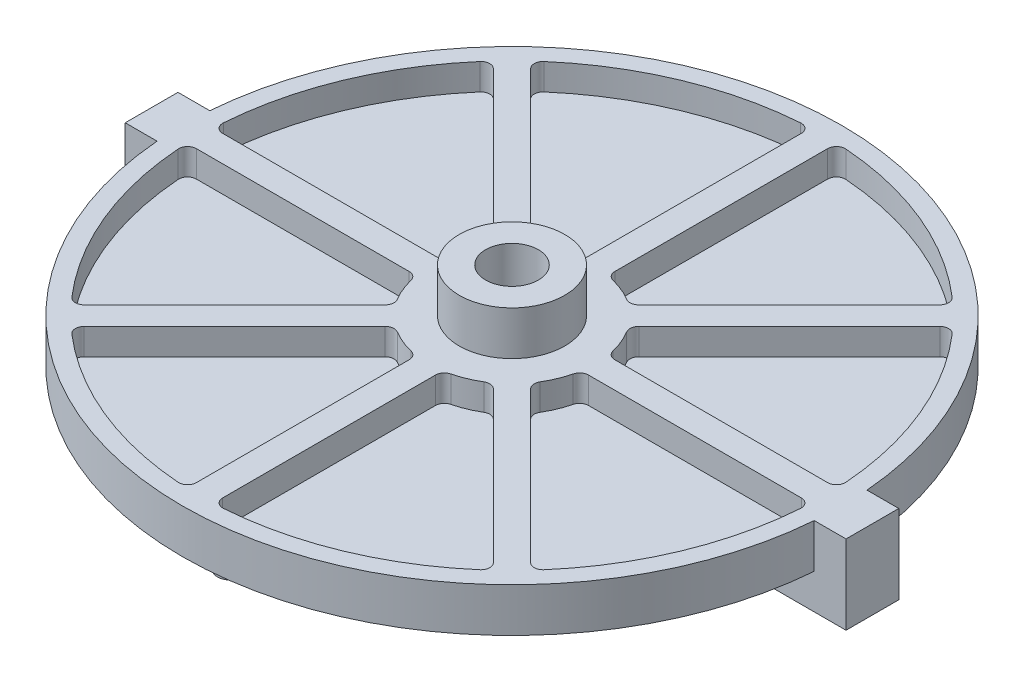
SolidWorks part; units mm, degrees
ref_plane "Front Plane" through (0, 0, 0) normal (0, 0, 1) x (1, 0, 0)
ref_plane "Top Plane" through (0, 0, 0) normal (0, 1, 0) x (1, 0, 0)
ref_plane "Right Plane" through (0, 0, 0) normal (1, 0, 0) x (0, 0, -1)
sketch "Sketch1" plane through (0, 0, 0) normal (0, 1, 0) x (1, 0, 0)
  circle A0 centre (0, 0) radius 37.5
  dimension "D1" = 75
extrude "Boss-Extrude1" add sketch "Sketch1" along normal blind 5
shell "Shell1" thickness 2
sketch "Sketch2" plane through (0, 2, 0) normal (0, 1, 0) x (1, 0, 0)
  circle A0 centre (0, 0) radius 9.5
  dimension "D1" = 19
extrude "Boss-Extrude2" add sketch "Sketch2" along normal up to surface (3 mm away)
sketch "Sketch3" plane through (0, 5, 0) normal (0, 1, 0) x (1, 0, 0)
  circle A0 centre (0, 0) radius 6
  dimension "D1" = 12
extrude "Boss-Extrude3" add sketch "Sketch3" along normal blind 5
sketch "Sketch4" plane through (0, 5, 0) normal (0, 1, 0) x (1, 0, 0)
  line L0 (0, 0) -> (35.5, 0)
  circle A0 centre (0, 0) radius 35.5 construction
rib "Rib1" sketch "Sketch4" sketch "Sketch4" thickness 3 extrusion direction normal to sketch draft on no parameters "D1"=3
pattern_circular "CirPattern1" count 8 over 360 about axis through (0, 0, 0) along (0, 1, 0) of "Rib1"
sketch "Sketch5" plane through (0, 0, 0) normal (0, -1, 0) x (1, 0, 0)
  line L0 (0, -17) -> (0, -32) construction
  line L1 (1.5, -17) -> (1.5, -32)
  line L2 (-1.5, -17) -> (-1.5, -32)
  line L3 (1.5, -35.4683) -> (1.5, -9.3808) construction
  arc A0 (1.5, -17) -> (-1.5, -17) centre (0, -17) ccw
  arc A1 (-1.5, -32) -> (1.5, -32) centre (0, -32) ccw
  circle A2 centre (0, 0) radius 32 construction
  point P3 (0, -24.5)
  dimension "D2" = 64
  dimension "D1" = 15
extrude "Boss-Extrude4" add sketch "Sketch5" along normal blind 4
mirror "Mirror1" about plane through (0, 0, 0) normal (0, 0, 1) of "Boss-Extrude4"
sketch "Sketch6" plane through (0, 0, 0) normal (0, -1, 0) x (1, 0, 0)
  line L0 (0, 0) -> (37.5, 0) construction
  line L1 (0, 0) -> (0, 40.6224) construction
  line L2 (-41, 3) -> (41, 3)
  line L3 (-41, 3) -> (-41, -3)
  line L4 (-41, -3) -> (41, -3)
  line L5 (41, 3) -> (41, -3)
  circle A0 centre (0, 0) radius 37.5 construction
  dimension "D1" = 82
  dimension "D2" = 6
extrude "Boss-Extrude5" add sketch "Sketch6" along normal up to surface (4 mm away)
sketch "Sketch7" plane through (0, 0, 0) normal (0, 1, 0) x (1, 0, 0)
  line L3 (41, 3) -> (37.3798, 3)
  line L4 (37.3798, -3) -> (41, -3)
  line L5 (41, -3) -> (41, 3)
  line L6 (41, 3) -> (37.3798, 3)
  line L7 (37.3798, -3) -> (41, -3)
  line L8 (41, -3) -> (41, 3)
  arc A1 (37.3798, -3) -> (37.3798, 3) centre (0, 0) ccw
  arc A2 (37.3798, -3) -> (37.3798, 3) centre (0, 0) ccw
  dimension "D1" = 0
extrude "Boss-Extrude6" add sketch "Sketch7" along normal up to surface (5 mm away)
sketch "Sketch8" plane through (0, 0, 0) normal (0, 1, 0) x (1, 0, 0)
  line L3 (-41, -3) -> (-37.3798, -3)
  line L4 (-37.3798, 3) -> (-41, 3)
  line L5 (-41, 3) -> (-41, -3)
  line L6 (-41, -3) -> (-37.3798, -3)
  line L7 (-37.3798, 3) -> (-41, 3)
  line L8 (-41, 3) -> (-41, -3)
  arc A1 (-37.3798, 3) -> (-37.3798, -3) centre (0, 0) ccw
  arc A2 (-37.3798, 3) -> (-37.3798, -3) centre (0, 0) ccw
  dimension "D1" = 0
extrude "Boss-Extrude7" add sketch "Sketch8" along normal up to surface (5 mm away)
hole_wizard "Ø6.0 (6) Diameter Hole1" positions "Sketch10" profile "Sketch9" hole size "Ø6.0" standard "ANSI Metric"
sketch "Sketch10" plane through (0, 10, 0) normal (0, 1, 0) x (1, 0, 0)
  point P0 (0, 0)
sketch "Sketch9" plane through (0, 10, 0) normal (1, 0, 0) x (0, 0, 1)
  line L0 (0, 0) -> (0, 9.8026)
  line L1 (0, 9.8026) -> (3, 8)
  line L2 (3, 8) -> (3, 0)
  line L5 (3, 0) -> (0, 0)
  line L10 (0, 9.8026) -> (-3, 8) construction
  line L11 (0, -6.35) -> (0, 107.95) construction
  dimension "Hole Dia." = 6
  dimension "Hole Depth" = 8
  dimension "Drill Angle" = 118
fillet "Fillet3" radius 1 32 edges at (-26.1405, 3.5, -24.0192) (-35.4683, 3.5, -1.5) (-9.3808, 3.5, -1.5) (-7.6939, 3.5, -5.5726) (-1.5, 3.5, -35.4683) (-24.0192, 3.5, -26.1405) (-5.5726, 3.5, -7.6939) (-1.5, 3.5, -9.3808) (35.4683, 3.5, 1.5) (9.3808, 3.5, 1.5) (7.6939, 3.5, 5.5726) (26.1405, 3.5, 24.0192) (24.0192, 3.5, 26.1405) (5.5726, 3.5, 7.6939) (1.5, 3.5, 9.3808) (1.5, 3.5, 35.4683) (-1.5, 3.5, 35.4683) (-1.5, 3.5, 9.3808) (-5.5726, 3.5, 7.6939) (-24.0192, 3.5, 26.1405) (35.4683, 3.5, -1.5) (26.1405, 3.5, -24.0192) (7.6939, 3.5, -5.5726) (-7.6939, 3.5, 5.5726) (-9.3808, 3.5, 1.5) (-35.4683, 3.5, 1.5) (-26.1405, 3.5, 24.0192) (24.0192, 3.5, -26.1405) (1.5, 3.5, -35.4683) (1.5, 3.5, -9.3808) (5.5726, 3.5, -7.6939) (9.3808, 3.5, -1.5)
